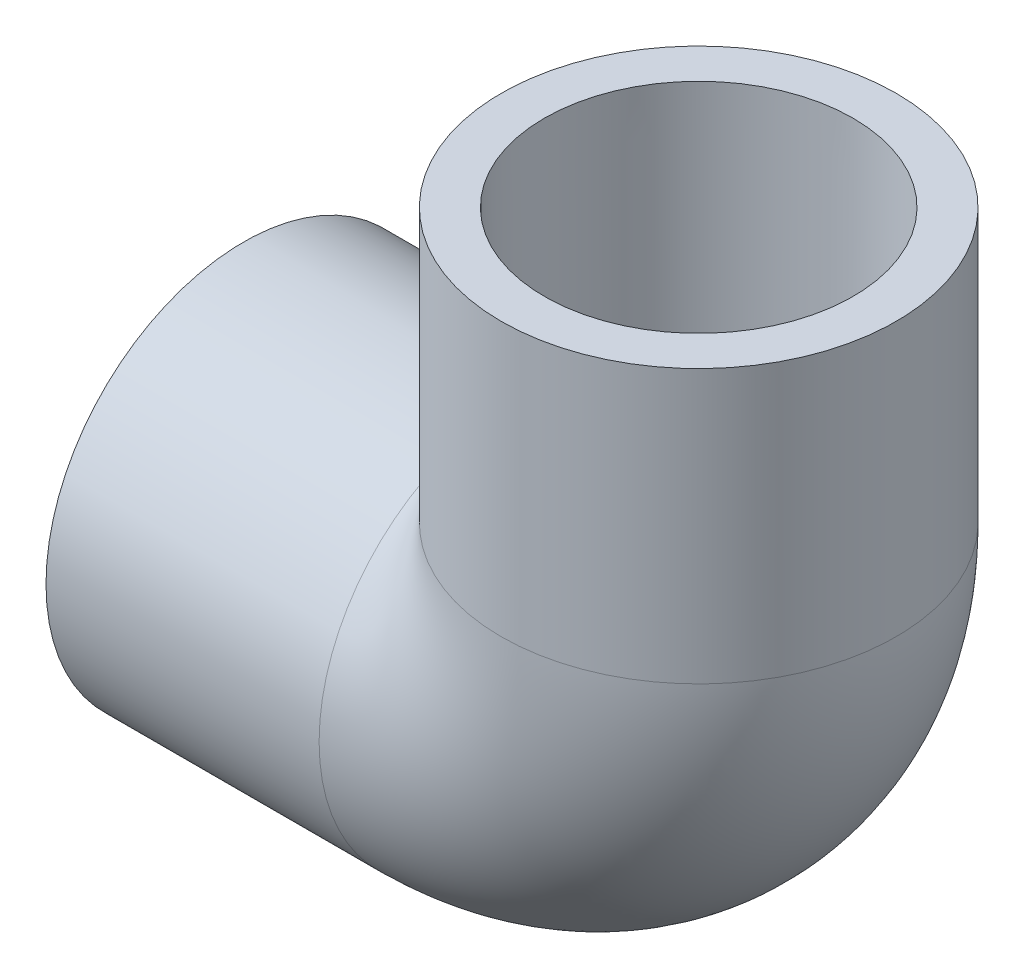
SolidWorks part; units mm, degrees
ref_plane "Front Plane" through (0, 0, 0) normal (0, 0, 1) x (1, 0, 0)
ref_plane "Top Plane" through (0, 0, 0) normal (0, 1, 0) x (1, 0, 0)
ref_plane "Right Plane" through (0, 0, 0) normal (1, 0, 0) x (0, 0, -1)
sketch "Sketch0" plane through (0, 0, 0) normal (0, 0, 1) x (1, 0, 0)
  line L0 (-31.75, 0) -> (0, 0) construction
  line L1 (0, 0) -> (0, 31.75) construction
  line L2 (-12.7, 0) -> (0, 0) construction
  line L3 (0, 0) -> (0, 12.7) construction
  line L4 (-31.75, 13.7795) -> (-31.75, -13.7795) construction
  line L5 (-12.7, 10.6172) -> (-31.75, 10.7696) construction
  line L6 (-12.7, 10.6172) -> (-12.7, -10.6172) construction
  line L7 (-12.7, -10.6172) -> (-31.75, -10.7696) construction
  line L8 (-31.75, 10.7696) -> (-31.75, -10.7696) construction
  line L9 (-13.7795, 31.75) -> (13.7795, 31.75) construction
  line L10 (-10.7696, 31.75) -> (10.7696, 31.75) construction
  line L11 (10.7696, 31.75) -> (10.6172, 12.7) construction
  line L12 (10.6172, 12.7) -> (-10.6172, 12.7) construction
  line L13 (-10.6172, 12.7) -> (-10.7696, 31.75) construction
  line L14 (-12.7, 7.8994) -> (-12.7, -7.8994) construction
  line L18 (-7.8994, 12.7) -> (7.8994, 12.7) construction
  dimension "H" = 31.75
  dimension "G" = 12.7
  dimension "M" = 27.559
  dimension "OD A" = 21.5392
  dimension "OD B" = 21.2344
  dimension "ID" = 15.7988
sketch "Sketch1" plane through (0, 0, 0) normal (0, 0, 1) x (1, 0, 0)
  line L0 (-31.75, 0) -> (0, 0) construction
  line L1 (-31.75, 0) -> (0, 0) construction
  line L3 (-31.75, -13.7795) -> (-12.7, -13.7795)
  line L4 (-31.75, -13.7795) -> (-31.75, -10.7696)
  line L5 (-31.75, -10.7696) -> (-12.7, -10.6172)
  line L6 (-12.7, -13.7795) -> (-12.7, -10.6172)
revolve "Revolve1" add sketch "Sketch1" angle 360 about L1
sketch "Sketch2" plane through (0, 0, 0) normal (0, 0, 1) x (1, 0, 0)
  line L0 (10.7696, 31.75) -> (10.6172, 12.7)
  line L1 (10.6172, 12.7) -> (13.7795, 12.7)
  line L2 (13.7795, 12.7) -> (13.7795, 31.75)
  line L3 (13.7795, 31.75) -> (10.7696, 31.75)
  line L4 (0, 0) -> (0, 31.75) construction
  line L5 (0, 0) -> (0, 31.75) construction
revolve "Revolve2" add sketch "Sketch2" angle 360 about L5
sketch "Sketch3" plane through (-12.7, 0, 0) normal (1, 0, 0) x (0, 0, -1)
  circle A0 centre (0, 0) radius 7.8994
  circle A1 centre (0, 0) radius 13.7795
sketch "Sketch4" plane through (0, 0, 0) normal (0, 0, 1) x (1, 0, 0)
  line L0 (-31.75, 0) -> (0, 0) construction
  line L1 (0, 0) -> (0, 31.75) construction
  line L2 (-31.75, 0) -> (-12.7, 0) construction
  line L3 (0, 12.7) -> (0, 31.75) construction
  arc A0 (-12.7, 0) -> (0, 12.7) centre (-12.7, 12.7) ccw
sweep "Sweep1" add profiles "Sketch3" path "Sketch4"
